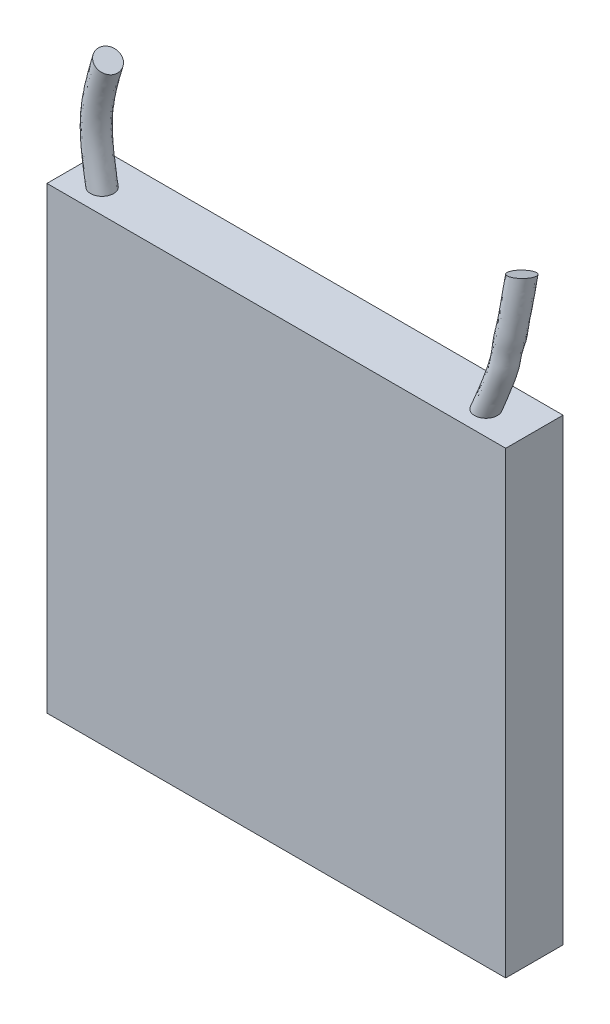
SolidWorks part; units mm, degrees
ref_plane "Plan de face" through (0, 0, 0) normal (0, 0, 1) x (1, 0, 0)
ref_plane "Plan de dessus" through (0, 0, 0) normal (0, 1, 0) x (1, 0, 0)
ref_plane "Plan de droite" through (0, 0, 0) normal (1, 0, 0) x (0, 0, -1)
sketch "Esquisse1" plane through (0, 0, 0) normal (0, 0, 1) x (1, 0, 0)
  line L1 (-29.7472, 20.9861) -> (10.2528, 20.9861)
  line L2 (-29.7472, 20.9861) -> (-29.7472, -19.0139)
  line L3 (-29.7472, -19.0139) -> (10.2528, -19.0139)
  line L4 (10.2528, 20.9861) -> (10.2528, -19.0139)
  dimension "D1" = 40
  dimension "D2" = 40
extrude "Extrusion1" add sketch "Esquisse1" along normal blind 5
sketch "Esquisse2" plane through (0, 20.9861, 0) normal (0, 1, 0) x (1, 0, 0)
  circle A0 centre (-27.07, -2.8702) radius 1
sketch3d "Esquisse3D1"
  spline S0 degree 3 poles (-27.07, 20.9861, 2.8702) (-27.4261, 22.5549, 2.7931) (-28.1731, 25.8454, 2.6312) (-27.1425, 29.0678, 2.7539) (-26.6033, 30.7538, 2.818) knots 0 0 0 0 0.476802 1 1 1 1
sweep "Balayage1" add profiles "Esquisse2" path "Esquisse3D1"
sketch "Esquisse4" plane through (0, 20.9861, 0) normal (0, 1, 0) x (1, 0, 0)
  circle A0 centre (6.4244, -2.8894) radius 1
sketch3d "Esquisse3D2"
  spline S0 degree 3 poles (6.4244, 20.9861, 2.8894) (7.0738, 22.5963, 2.8496) (7.7233, 24.2065, 2.8097) (8.5789, 28.1425, 2.7076) (8.7894, 30.1548, 2.5233) (8.9999, 32.1671, 2.3391) knots 0 0 0 0 0.28865 0.28865 1 1 1 1
sweep "Balayage2" add profiles "Esquisse4" path "Esquisse3D2"
